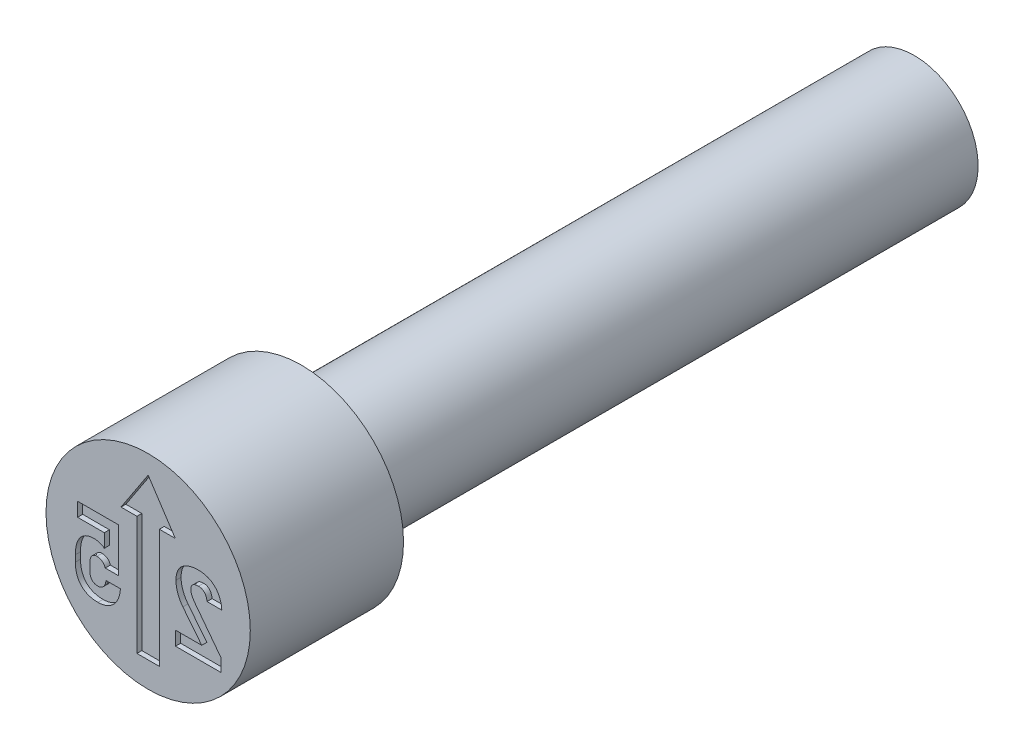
SolidWorks part; units mm, degrees
ref_plane "Front Plane" through (0, 0, 0) normal (0, 0, 1) x (1, 0, 0)
ref_plane "Top Plane" through (0, 0, 0) normal (0, 1, 0) x (1, 0, 0)
ref_plane "Right Plane" through (0, 0, 0) normal (1, 0, 0) x (0, 0, -1)
imported_body "Imported1"
sketch "Sketch1" plane through (0, 0, -0.3556) normal (0, 0, 1) x (1, 0, 0)
  line L7 (0.5321, 0.8255) -> (0, 1.6331)
  line L8 (0, 1.6331) -> (-0.5321, 0.8255)
  line L9 (-0.5321, 0.8255) -> (-0.22, 0.8255)
  line L10 (-0.22, 0.8255) -> (-0.22, -1.5)
  line L11 (-0.22, -1.5) -> (0.22, -1.5)
  line L12 (0.22, -1.5) -> (0.22, 0.8255)
  line L13 (0.22, 0.8255) -> (0.5321, 0.8255)
  line L14 (0.5321, 0.8255) -> (0, 1.6331)
  line L15 (0, 1.6331) -> (-0.5321, 0.8255)
  line L16 (-0.5321, 0.8255) -> (-0.22, 0.8255)
  line L17 (-0.22, 0.8255) -> (-0.22, -1.5)
  line L18 (-0.22, -1.5) -> (0.22, -1.5)
  line L19 (0.22, -1.5) -> (0.22, 0.8255)
  line L20 (0.22, 0.8255) -> (0.5321, 0.8255)
  dimension "D1" = 0
extrude "Boss-Extrude1" add sketch "Sketch1" along normal blind 0.26
sketch "Sketch2" plane through (0, 0, 0) normal (0, 0, 1) x (1, 0, 0)
  text T0 "2  5" font "Bahnschrift" height 1.5
  dimension "D2" = 1
extrude "Cut-Extrude1" cut sketch "Sketch2" against normal blind 0.1
